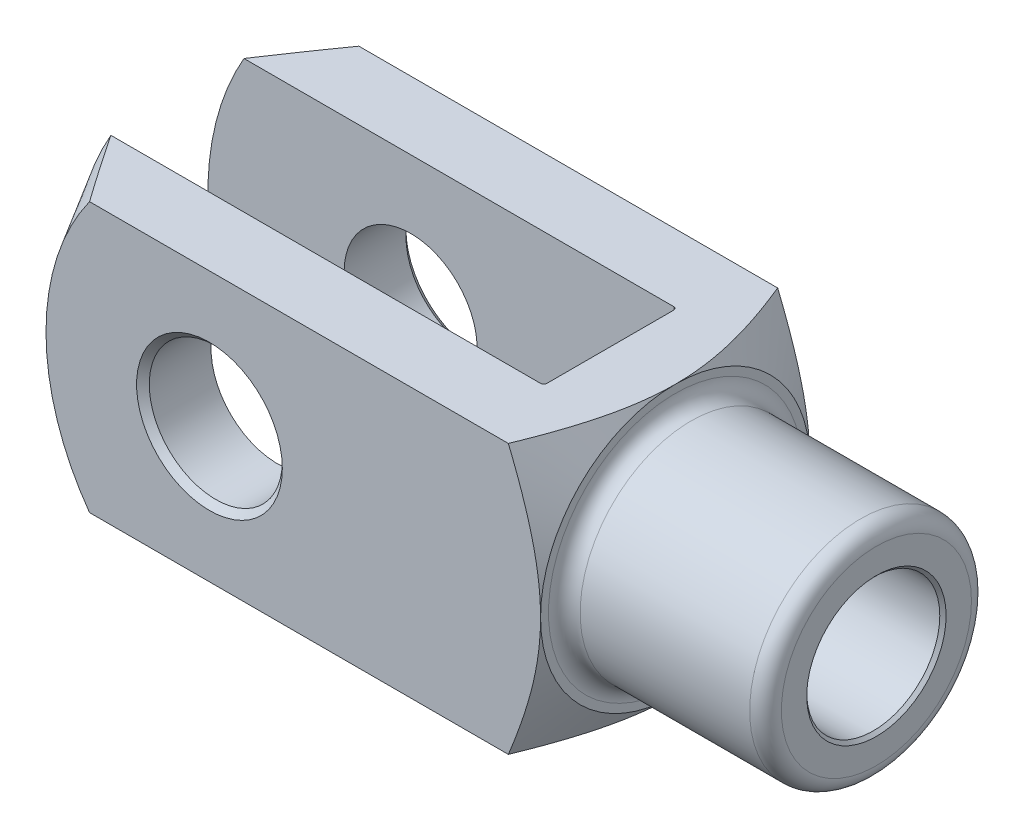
SolidWorks part; units mm, degrees
ref_plane "Front Plane" through (0, 0, 0) normal (0, 0, 1) x (1, 0, 0)
ref_plane "Top Plane" through (0, 0, 0) normal (0, 1, 0) x (1, 0, 0)
ref_plane "Right Plane" through (0, 0, 0) normal (1, 0, 0) x (0, 0, -1)
sketch "Sketch1" plane through (0, 0, 0) normal (1, 0, 0) x (0, 0, -1)
  line L0 (0, 0) -> (0, 50000) construction
  line L1 (0, 0) -> (50000, 0) construction
  line L2 (-42.5, -42.5) -> (-42.5, 42.5)
  line L3 (-42.5, 42.5) -> (42.5, 42.5)
  line L4 (42.5, -42.5) -> (42.5, 42.5)
  line L5 (-42.5, -42.5) -> (42.5, -42.5)
  point P9 (0, 42.5)
  point P11 (42.5, 0)
  point P12 (-42.5, 0)
  dimension "D1" = 85
  dimension "D2" = 85
extrude "Extrude1" add sketch "Sketch1" against normal blind 232
sketch "Sketch2" plane through (0, 0, 0) normal (1, 0, 0) x (0, 0, -1)
  circle A0 centre (0, 0) radius 35
  circle A1 centre (0, 0) radius 70
  dimension "D1" = 70
  dimension "D2" = 140
extrude "Extrude2" cut sketch "Sketch2" against normal blind 63.5
sketch "Sketch3" plane through (0, 0, 42.5) normal (0, 0, 1) x (1, 0, 0)
  circle A0 centre (-168, 0) radius 21
  dimension "D1" = 42
  dimension "D2" = 168
extrude "Extrude3" cut sketch "Sketch3" against normal through all
sketch "Sketch4" plane through (0, 42.5, 0) normal (0, 1, 0) x (1, 0, 0)
  line L0 (0, 0) -> (-50000, 0) construction
  line L1 (-232, -21) -> (-232, 21)
  line L2 (-232, 42.5) -> (-232, -42.5) construction
  line L3 (-232, 21) -> (-84, 21)
  line L4 (-84, 21) -> (-84, -21)
  line L5 (-168, 42.5) -> (-168, -42.5) construction
  line L6 (-232, -21) -> (-84, -21)
  point P7 (-168, 0)
  point P13 (-84, 0)
  point P14 (-232, 0)
  dimension "D1" = 84
  dimension "D2" = 42
extrude "Extrude4" cut sketch "Sketch4" against normal through all
fillet "Fillet1" radius 1 2 edges at (-84, 0, 21) (-84, 0, -21)
fillet "Fillet2" radius 5 2 edges at (0, 0, -35) (-63.5, 0, -35)
chamfer "Chamfer2" distance 2 angle 45 2 edges at (-147, 0, -42.5) (-147, 0, 42.5)
sketch "Sketch6" plane through (0, 0, 0) normal (0, 0, 1) x (1, 0, 0)
  line L0 (-63.5, -42.5) -> (-63.5, -85)
  line L1 (-63.5, -85) -> (-88.0374, -85)
  line L2 (-88.0374, -85) -> (-63.5, -42.5)
  dimension "D1" = 30
  dimension "D2" = 85
revolve "Cut-Revolve1" cut sketch "Sketch6" angle 360 about axis through (-63.5, 0, 0) along (1, 0, 0)
sketch "Sketch7" plane through (0, 0, 0) normal (0, 1, 0) x (1, 0, 0)
  line L0 (-219.587, -42.5) -> (-232, -21)
  line L1 (-232, 21) -> (-219.587, 42.5)
  line L2 (-219.587, 42.5) -> (-317, 42.5)
  line L3 (-232, 21) -> (-232, -21)
  line L4 (-317, 42.5) -> (-317, -42.5)
  line L5 (-317, -42.5) -> (-219.587, -42.5)
  line L6 (-232, 42.5) -> (-73.6637, 42.5) construction
  line L7 (-232, -42.5) -> (-73.6637, -42.5) construction
  line L8 (-147, 0.6162) -> (-147, 50000.6162) construction
  dimension "D1" = 120
  dimension "D2" = 85
  dimension "D3" = 85
revolve "Cut-Revolve2" cut sketch "Sketch7" angle 180 about L8
sketch "Sketch8" plane through (0, 0, 0) normal (1, 0, 0) x (0, 0, -1)
  circle A0 centre (0, 0) radius 21
  dimension "D1" = 42
extrude "Extrude5" cut sketch "Sketch8" against normal through all
chamfer "Chamfer3" distance 1 angle 45 1 edges at (0, 0, -21)
equation "\"D2@Sketch1\" = \"D1@Sketch1\""
equation "\"D2@Sketch2\" = \"D1@Sketch2\"*2"
equation "\"D2@Sketch6\" = \"D1@Sketch1\""
equation "\"D2@Sketch7\" = \"D1@Sketch1\""
equation "\"D3@Sketch7\" = \"D1@Sketch1\""
